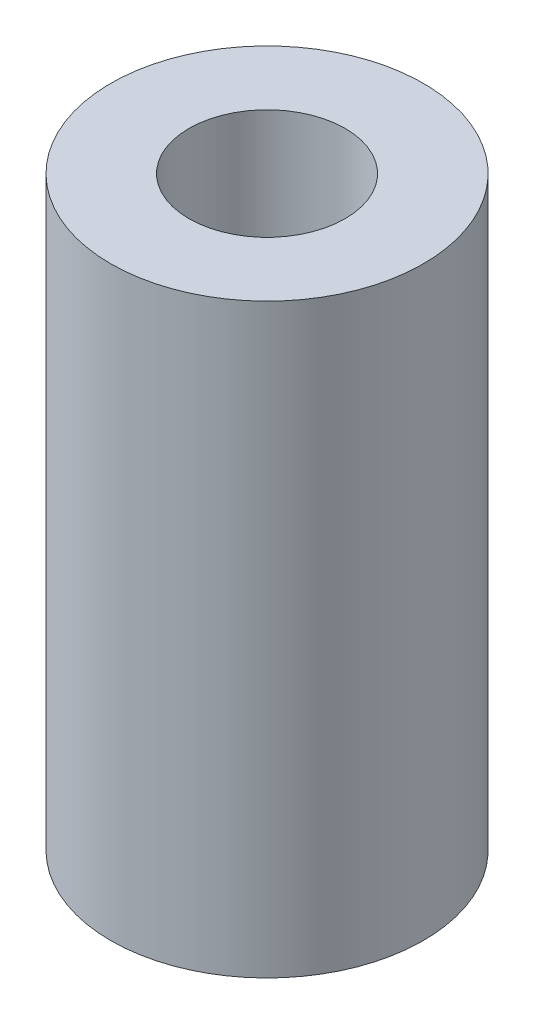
SolidWorks part; units mm, degrees
ref_plane "Plane1" through (0, 0, 0) normal (0, 0, 1) x (1, 0, 0)
ref_plane "Plane2" through (0, 0, 0) normal (0, 1, 0) x (1, 0, 0)
ref_plane "Plane3" through (0, 0, 0) normal (1, 0, 0) x (0, 0, -1)
sketch "Sketch1" plane through (0, 0, 0) normal (0, 0, 1) x (1, 0, 0)
  line L0 (0, 44.1274) -> (0, -33.6565) construction
  line L1 (-32.036, 0) -> (26.5512, 0) construction
  line L2 (2, 7) -> (2, 0)
  line L3 (2, 0) -> (1.5, 0)
  line L4 (1.5, 0) -> (1.5, -7.5)
  line L5 (1.5, -7.5) -> (2, -8)
  line L6 (2, -8) -> (4, -8)
  line L7 (4, -8) -> (4, 7)
  line L8 (4, 7) -> (2, 7)
  dimension "D1" = 4
  dimension "D2" = 7
  dimension "D3" = 3
  dimension "D4" = 8
  dimension "D5" = 45
  dimension "D6" = 0.5
  dimension "D7" = 8
revolve "Base-Revolve" add sketch "Sketch1" angle 360 about L0
